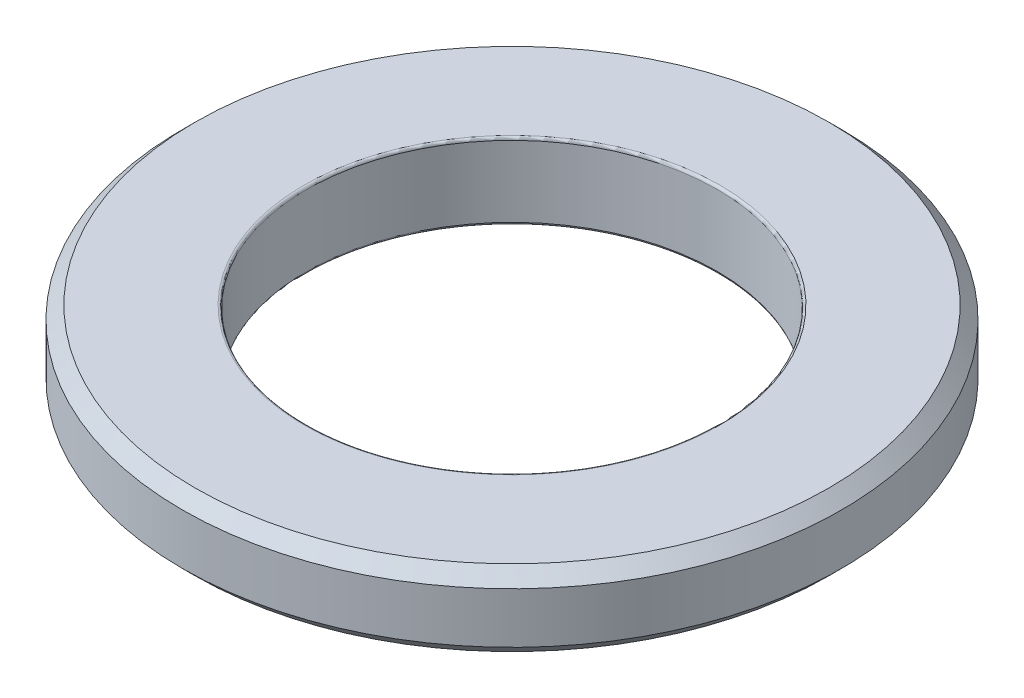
SolidWorks part; units mm, degrees
ref_plane "Plan de face" through (0, 0, 0) normal (0, 0, 1) x (1, 0, 0)
ref_plane "Plan de dessus" through (0, 0, 0) normal (0, 1, 0) x (1, 0, 0)
ref_plane "Plan de droite" through (0, 0, 0) normal (1, 0, 0) x (0, 0, -1)
sketch "Esquisse1" plane through (0, 0, 0) normal (0, 0, 1) x (1, 0, 0)
  line L0 (0, 0) -> (0, 68.2346) construction
  line L1 (-8.1, 0) -> (-13, 0)
  line L2 (-13, 0) -> (-13, 3)
  line L3 (-13, 3) -> (-8.1, 3)
  line L5 (-8.1, 3) -> (-8.1, 0)
  dimension "D1" = 26
  dimension "D2" = 16.2
  dimension "D3" = 3
revolve "Révolution1" add sketch "Esquisse1" angle 360 about L0
fillet "Congé1" radius 0.1 2 edges at (0, 0, -8.1) (0, 3, -8.1)
chamfer "Chanfrein1" distance 0.5 angle 45 2 edges at (0, 0, -13) (0, 3, -13)
